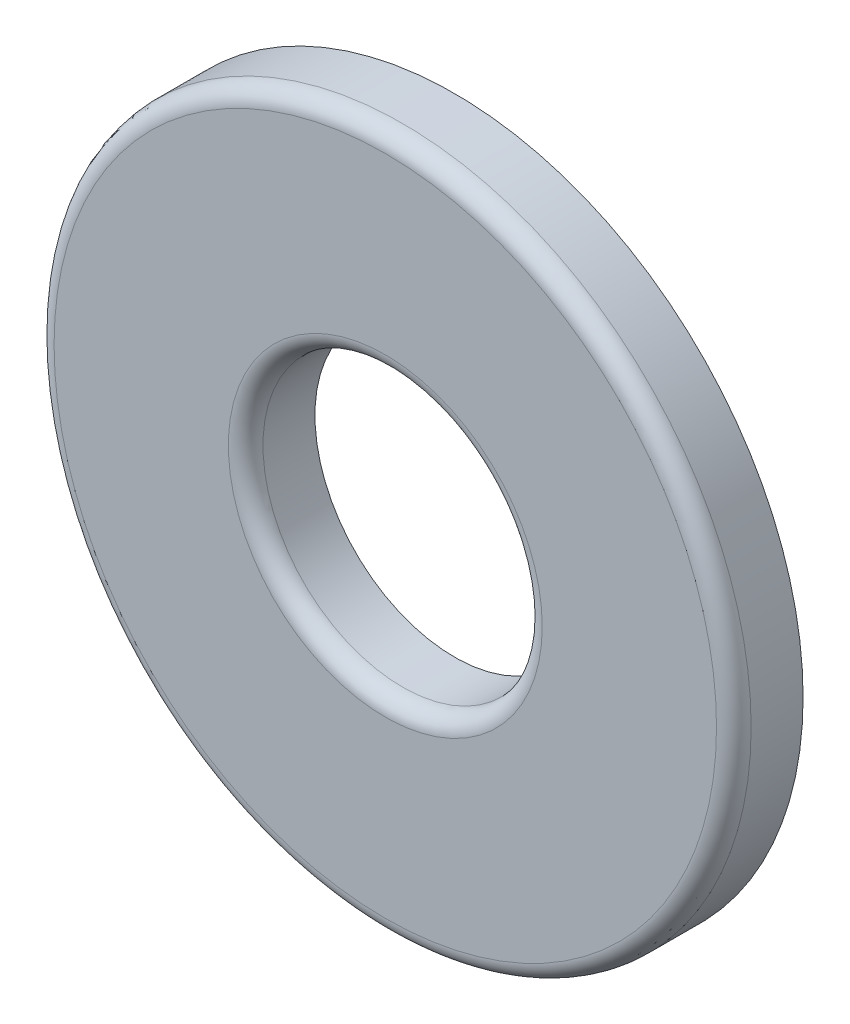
SolidWorks part; units mm, degrees
other "Imported1" parameters "D1"=0.1968, "TH"=1.0287, "Thickness"=0.7874
ref_plane "Front Plane" through (0, 0, 0) normal (0, 0, 1) x (1, 0, 0)
ref_plane "Top Plane" through (0, 0, 0) normal (0, 1, 0) x (1, 0, 0)
ref_plane "Right Plane" through (0, 0, 0) normal (1, 0, 0) x (0, 0, -1)
sketch "Sketch1" plane through (0, 0, 0) normal (0, 0, 1) x (1, 0, 0)
  line L0 (-3.9624, 0) -> (3.9624, 0) construction
  line L1 (-1.5875, 0) -> (1.5875, 0) construction
  circle A0 centre (0, 0) radius 1.5875 construction
  circle A1 centre (0, 0) radius 3.9624 construction
  point P8 (0, 0)
  point P9 (0, 3.9624)
  point P11 (1.5875, 0)
  dimension "ID" = 3.175
  dimension "OD" = 7.9248
sketch "Sketch2" plane through (0, 0, 0) normal (1, 0, 0) x (0, 0, -1)
  line L0 (-0.3937, 3.9624) -> (0.3937, 3.9624) construction
  point P2 (0, 3.9624)
sketch "Sketch3" plane through (0, 0, 0) normal (0, 0, 1) x (1, 0, 0)
  circle A0 centre (0, 0) radius 1.5875
  circle A1 centre (0, 0) radius 3.9624
extrude "Boss-Extrude1" add sketch "Sketch3" along normal up to vertex (0.3937 mm away) and the other way up to vertex (0.3937 mm away)
fillet "Fillet1" radius 0.1968 2 edges at (3.9624, 0, 0.3937) (1.5875, 0, 0.3937)
equation "\"D1@Fillet1\"=\"Thickness@Sketch2\"/4"
